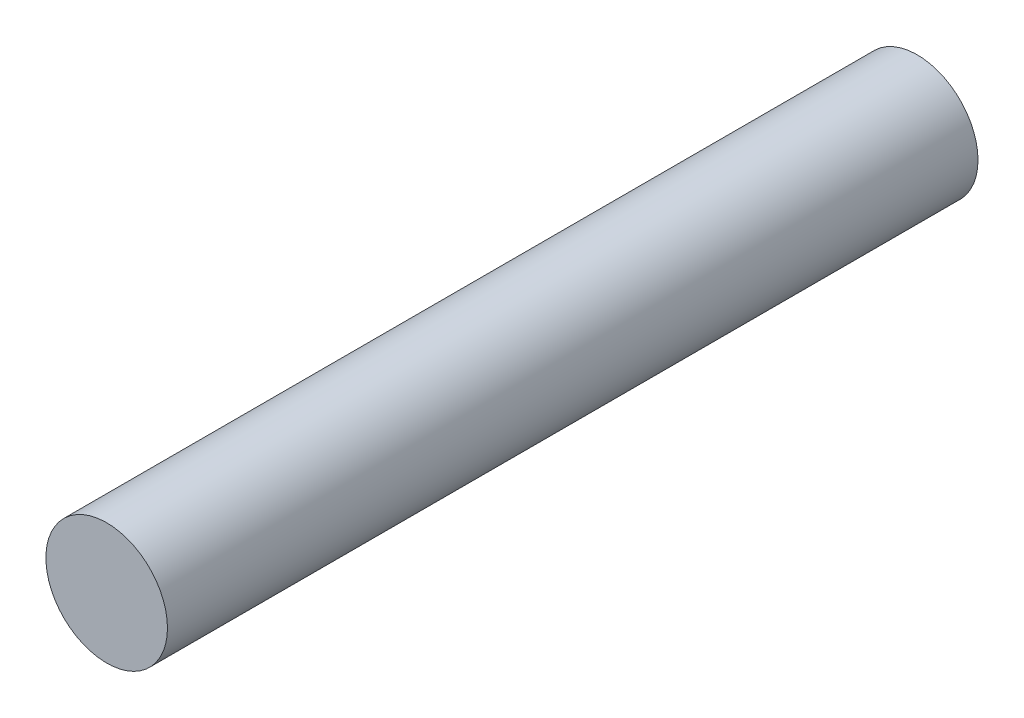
SolidWorks part; units mm, degrees
ref_plane "Front Plane" through (0, 0, 0) normal (0, 0, 1) x (1, 0, 0)
ref_plane "Top Plane" through (0, 0, 0) normal (0, 1, 0) x (1, 0, 0)
ref_plane "Right Plane" through (0, 0, 0) normal (1, 0, 0) x (0, 0, -1)
sketch "Sketch1" plane through (0, 0, 0) normal (0, 0, 1) x (1, 0, 0)
  circle A0 centre (0, 0) radius 30
  dimension "D1" = 60
extrude "Boss-Extrude1" add sketch "Sketch1" against normal blind 400
